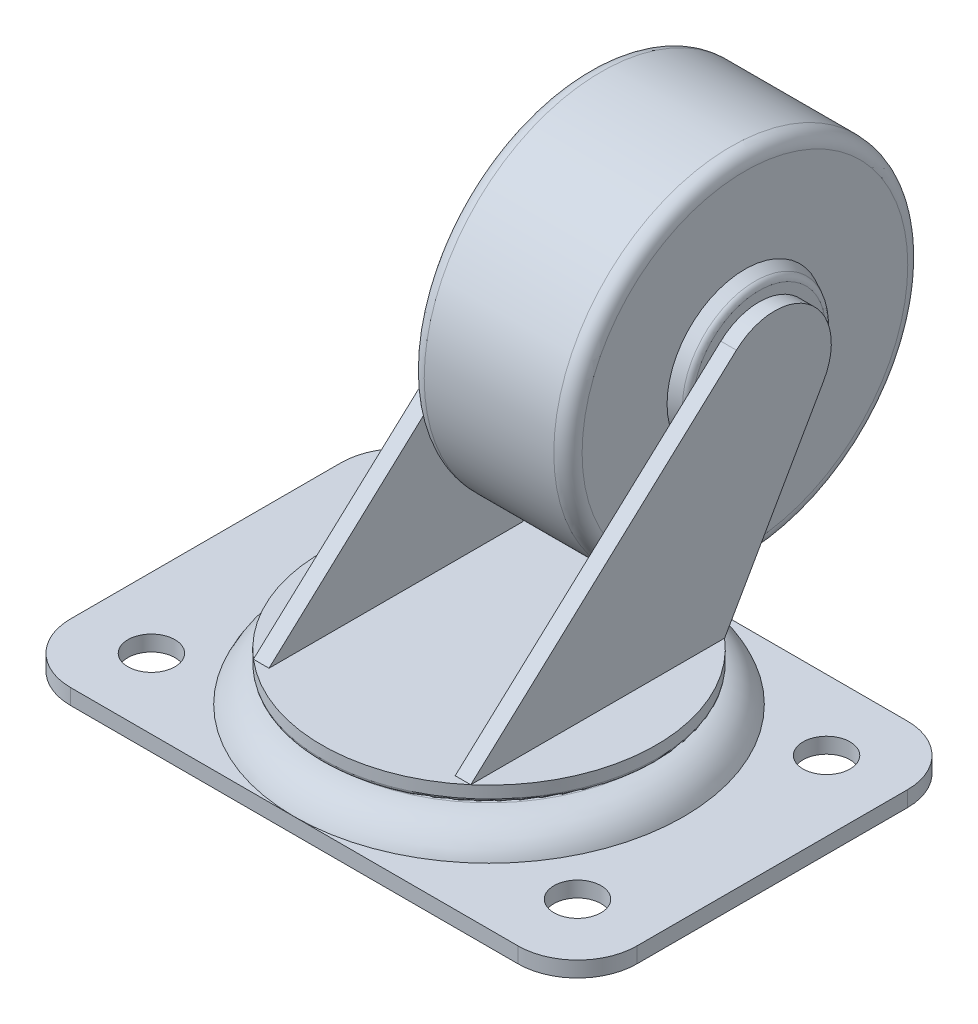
SolidWorks part; units mm, degrees
other "DetailItem1"
ref_plane "Front Plane" through (0, 0, 0) normal (0, 0, 1) x (1, 0, 0)
ref_plane "Top Plane" through (0, 0, 0) normal (0, 1, 0) x (1, 0, 0)
ref_plane "Right Plane" through (0, 0, 0) normal (1, 0, 0) x (0, 0, -1)
sketch "Sketch10" plane through (0, 0, 0) normal (0, 0, 1) x (1, 0, 0)
  line L0 (0, 0) -> (0, 2.794)
  dimension "D1" = 2.794
sketch "Sketch1" plane through (0, 0, 0) normal (0, 1, 0) x (1, 0, 0)
  line L0 (38.2143, 22.3393) -> (50.8, 22.3393) construction
  line L1 (-40.132, 34.925) -> (40.132, 34.925)
  line L2 (-50.8, 24.257) -> (-50.8, -24.257)
  line L3 (-40.132, -34.925) -> (40.132, -34.925)
  line L4 (50.8, 24.257) -> (50.8, -24.257)
  line L5 (-38.2143, 22.3393) -> (-50.8, 22.3393) construction
  line L6 (38.2143, 22.3393) -> (38.2143, 34.925) construction
  line L7 (38.2143, -22.3393) -> (38.2143, -34.925) construction
  circle A0 centre (38.2143, 22.3393) radius 4.2164
  circle A1 centre (-38.2143, 22.3393) radius 4.2164
  circle A2 centre (-38.2143, -22.3393) radius 4.2164
  circle A3 centre (38.2143, -22.3393) radius 4.2164
  arc A4 (-50.8, -24.257) -> (-40.132, -34.925) centre (-40.132, -24.257) ccw
  arc A5 (40.132, -34.925) -> (50.8, -24.257) centre (40.132, -24.257) ccw
  arc A6 (40.132, 34.925) -> (50.8, 24.257) centre (40.132, 24.257) cw
  arc A7 (-40.132, 34.925) -> (-50.8, 24.257) centre (-40.132, 24.257) ccw
  point P4 (-50.8, 0)
  point P5 (0, 34.925)
  point P19 (50.8, -34.925)
  point P22 (50.8, 34.925)
  point P25 (-50.8, 34.925)
  dimension "D4" = 8.4328
  dimension "D5" = 76.4286
  dimension "D6" = 10.668
  dimension "D1" = 101.6
  dimension "D2" = 69.85
  dimension "D3" = 44.6786
extrude "Mounting Plate (MP)" add sketch "Sketch1" along normal up to vertex (2.794 mm away)
sketch "Sketch2" plane through (0, 0, 0) normal (0, 0, 1) x (1, 0, 0)
  line L1 (0, 7.366) -> (-28.1095, 7.366)
  line L2 (0, 0) -> (-35.4755, 0) construction
  line L3 (-40.132, 0) -> (40.132, 0) construction
  line L5 (-40.132, 2.794) -> (40.132, 2.794) construction
  line L6 (-28.1095, 7.366) -> (-35.4755, 7.366) construction
  line L7 (-35.4755, 7.366) -> (-35.4755, 0) construction
  line L8 (-34.925, 2.794) -> (0, 2.794) construction
  line L9 (0, 2.794) -> (34.925, 2.794) construction
  line L10 (-34.925, 2.794) -> (0, 2.794)
  line L11 (0, 2.794) -> (0, 7.366)
  arc A0 (-28.1095, 7.366) -> (-34.925, 2.794) centre (-28.1095, 0) ccw
  arc A1 (-34.925, 2.794) -> (-35.4755, 0) centre (-28.1095, 0) ccw construction
  point P10 (-34.925, 2.794)
  dimension "D1" = 4.572
  dimension "D2" = 69.85
revolve "MP Bearing Retainer" add sketch "Sketch2" angle 360 about L11
sketch "Sketch3" plane through (0, 0, 0) normal (0, 0, 1) x (1, 0, 0)
  line L0 (0, 7.366) -> (-6.35, 7.366)
  line L1 (28.1095, 7.366) -> (-28.1095, 7.366) construction
  line L2 (-6.35, 7.366) -> (-6.35, 8.636)
  line L3 (-6.35, 8.636) -> (-29.972, 8.636)
  line L4 (-29.972, 8.636) -> (-29.972, 11.43)
  line L5 (-29.972, 11.43) -> (0, 11.43)
  line L6 (0, 11.43) -> (0, 7.366)
  dimension "D1" = 29.972
  dimension "D2" = 1.27
  dimension "D3" = 6.35
  dimension "D4" = 2.794
revolve "Caster Wheel Base" add sketch "Sketch3" angle 360 about L6
sketch "Control Sketch" plane through (0, 11.43, 0) normal (0, 1, 0) x (1, 0, 0)
  line L2 (14.1605, 0) -> (14.1605, 63.5) construction
  line L3 (14.1605, 63.5) -> (-14.1605, 63.5) construction
  line L4 (-14.1605, 63.5) -> (-14.1605, 0) construction
  line L5 (-14.1605, 31.75) -> (14.1605, 31.75) construction
  line L6 (-14.1605, 0) -> (14.1605, 0) construction
  line L7 (0, -34.925) -> (40.132, -34.925) construction
  line L8 (14.1605, 44.45) -> (19.4945, 44.45) construction
  line L9 (0, 0) -> (0, 31.75) construction
  line L10 (0, 31.75) -> (0, 63.5) construction
  line L12 (19.4945, 44.45) -> (19.4945, 19.05) construction
  line L13 (19.4945, 19.05) -> (14.1605, 19.05) construction
  line L14 (14.1605, 31.75) -> (19.4945, 31.75) construction
  line L15 (-14.1605, 44.45) -> (-19.4945, 44.45) construction
  line L16 (-19.4945, 44.45) -> (-19.4945, 19.05) construction
  line L17 (-19.4945, 19.05) -> (-14.1605, 19.05) construction
  line L18 (-19.4945, 31.75) -> (-14.1605, 31.75) construction
  dimension "D1" = 90
  dimension "D2" = 63.5
  dimension "D3" = 28.321
  dimension "D4" = 31.75
  dimension "D5" = 5.334
  dimension "D6" = 25.4
ref_plane "Wheel Center Plane" through (0, 0, 0) normal (-1, 0, 0) x (0, 0, 1)
ref_plane "Wheel Mount Plane" through (19.4945, 0, 0) normal (-1, 0, 0) x (0, 0, 1)
sketch "Sketch7" plane through (19.4945, 0, 0) normal (-1, 0, 0) x (0, 0, 1)
  line L0 (0, 47.625) -> (-63.5, 47.625) construction
  line L1 (24.257, 0) -> (-24.257, 0) construction
  line L2 (-24.8842, 55.1141) -> (22.7659, 11.43)
  line L3 (-40.571, 42.5836) -> (-22.7659, 11.43)
  line L7 (22.7659, 11.43) -> (-22.7659, 11.43)
  line L8 (-41.91, 47.625) -> (-44.45, 47.625) construction
  circle A0 centre (-31.75, 47.625) radius 31.75 construction
  arc A1 (-24.8842, 55.1141) -> (-40.571, 42.5836) centre (-31.75, 47.625) ccw
  point P4 (-31.75, 79.375)
  dimension "D1" = 79.375
  dimension "D2" = 2.54
extrude "Wheel Support 1" add sketch "Sketch7" along normal blind 2.794
mirror "Wheel Support 2" about plane through (0, 0, 0) normal (-1, 0, 0) of "Wheel Support 1"
ref_plane "Wheel Drawing Plane" through (0, 47.625, 0) normal (0, 1, 0) x (1, 0, 0)
sketch "Sketch9" plane through (0, 47.625, 0) normal (0, 1, 0) x (1, 0, 0)
  line L0 (-16.7005, 31.75) -> (16.7005, 31.75)
  line L3 (16.7005, 31.75) -> (16.7005, 43.6651)
  line L4 (14.1605, 44.45) -> (19.4945, 44.45) construction
  line L5 (15.9985, 44.801) -> (14.1605, 45.72)
  line L6 (14.1605, 0) -> (14.1605, 63.5) construction
  line L7 (14.1605, 45.72) -> (14.1605, 63.5)
  line L8 (14.1605, 63.5) -> (-14.1605, 63.5)
  line L9 (-14.1605, 63.5) -> (-14.1605, 45.72)
  line L10 (-14.1605, 63.5) -> (-14.1605, 0) construction
  line L11 (-14.1605, 45.72) -> (14.1605, 45.72) construction
  line L12 (0, 31.75) -> (0, 63.5) construction
  line L13 (-14.1605, 45.72) -> (-15.9985, 44.801)
  line L15 (-16.7005, 43.6651) -> (-16.7005, 31.75)
  line L17 (-19.4945, 31.75) -> (-14.1605, 31.75) construction
  line L18 (-16.7005, 24.8842) -> (-16.7005, 41.91) construction
  line L19 (-14.1605, 44.45) -> (-19.4945, 44.45) construction
  line L20 (16.7005, 41.91) -> (16.7005, 24.8842) construction
  arc A0 (16.7005, 43.6651) -> (15.9985, 44.801) centre (15.4305, 43.6651) ccw
  arc A1 (-15.9985, 44.801) -> (-16.7005, 43.6651) centre (-15.4305, 43.6651) ccw
  point P29 (16.7005, 44.45)
  point P32 (-16.7005, 44.45)
  dimension "D2" = 1.27
  dimension "D1" = 1.27
revolve "Revolve3" add sketch "Sketch9" angle 360 about L0
fillet "Fillet1" radius 2.54 2 edges at (-14.1605, 47.625, 0) (14.1605, 47.625, 0)
fillet "Fillet2" radius 0.635 1 edges at (-29.972, 8.636, 0)
